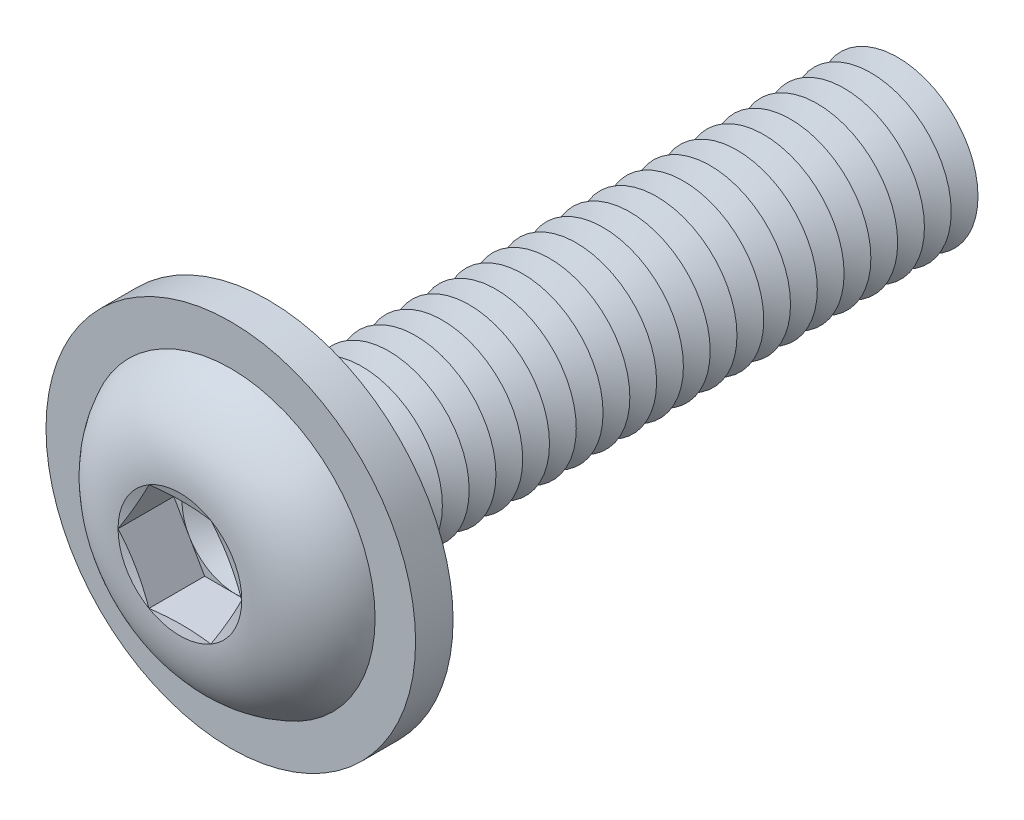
SolidWorks part; units mm, degrees
ref_plane "Front Plane" through (0, 0, 0) normal (0, 0, 1) x (1, 0, 0)
ref_plane "Top Plane" through (0, 0, 0) normal (0, 1, 0) x (1, 0, 0)
ref_plane "Right Plane" through (0, 0, 0) normal (1, 0, 0) x (0, 0, -1)
sketch "Sketch1" plane through (0, 0, 0) normal (1, 0, 0) x (0, 0, -1)
  line L0 (0, 1.5) -> (0, 2.85)
  line L3 (0, 1.5) -> (12, 1.5)
  line L4 (12, 1.5) -> (12, 0)
  line L5 (12, 0) -> (-1.65, 0) construction
  line L6 (-1.65, 0) -> (12, 0)
  line L7 (-1.65, 1.1547) -> (-1.65, 0.5773) construction
  line L8 (-1.65, 0.5773) -> (-1.65, 0)
  line L9 (-1.65, 1.1547) -> (-1.4953, 0.5773)
  line L10 (-1.4953, 0.5773) -> (-1.65, 0.5773)
  line L11 (12, 0) -> (22.7481, 0) construction
  line L12 (0, 2.85) -> (-1.65, 2.85) construction
  arc A1 (0, 2.85) -> (-1.65, 1.1547) centre (0, 1.1994) ccw
  point P8 (12, 0.75)
  dimension "D1" = 5.7
  dimension "D2" = 3
  dimension "D3" = 1.65
  dimension "D4" = 2.3094
  dimension "D5" = 12
  dimension "D6" = 15
revolve "Revolve1" add sketch "Sketch1" angle 360 about L5
fillet "Fillet1" radius 0.25 1 edges at (-1.5, 0, 0)
sketch "Sketch2" plane through (0, 0, 0) normal (1, 0, 0) x (0, 0, -1)
  line L0 (11.75, 1.5) -> (12.25, 1.5)
  line L1 (12, 1.5) -> (0.25, 1.5) construction
  line L2 (12.25, 1.5) -> (12, 1.067)
  line L3 (12, -1.5) -> (12, 1.5) construction
  line L4 (12, 1.067) -> (11.75, 1.5)
  dimension "D1" = 0.5
revolve "Cut-Revolve1" cut sketch "Sketch2" angle 360 about axis through (0, 0, -12) along (0, 0, -1)
pattern_linear "LPattern1" count 24 spacing 0.5 along (0, 0, 1) of "Cut-Revolve1"
sketch "Sketch3" plane through (0, 0, 1.65) normal (0, 0, 1) x (1, 0, 0)
  line L7 (0.5773, 1) -> (-0.5774, 1)
  line L8 (-0.5774, 1) -> (-1.1547, 0)
  line L9 (-1.1547, 0) -> (-0.5773, -1)
  line L10 (-0.5773, -1) -> (0.5773, -1)
  line L11 (0.5773, -1) -> (1.1547, 0)
  line L12 (1.1547, 0) -> (0.5773, 1)
  circle A0 centre (0, 0) radius 1 construction
  circle A3 centre (0, 0) radius 1.1547 construction
extrude "Cut-Extrude1" cut sketch "Sketch3" against normal blind 1.04
sketch "Sketch4" plane through (0, 0, 0.61) normal (0, 0, 1) x (1, 0, 0)
  line L1 (0.5773, 1) -> (-0.5774, 1) construction
  circle A0 centre (0, 0) radius 1
extrude "Cut-Extrude2" cut sketch "Sketch4" against normal through all draft 60
sketch "Sketch5" plane through (0, 0, 0) normal (0, 0, -1) x (-1, 0, 0)
  circle A0 centre (0, 0) radius 3.45
  circle A1 centre (0, 0) radius 1.75
  circle A2 centre (0, 0) radius 1.75 construction
  dimension "D1" = 6.9
extrude "Boss-Extrude1" add sketch "Sketch5" against normal blind 0.7
